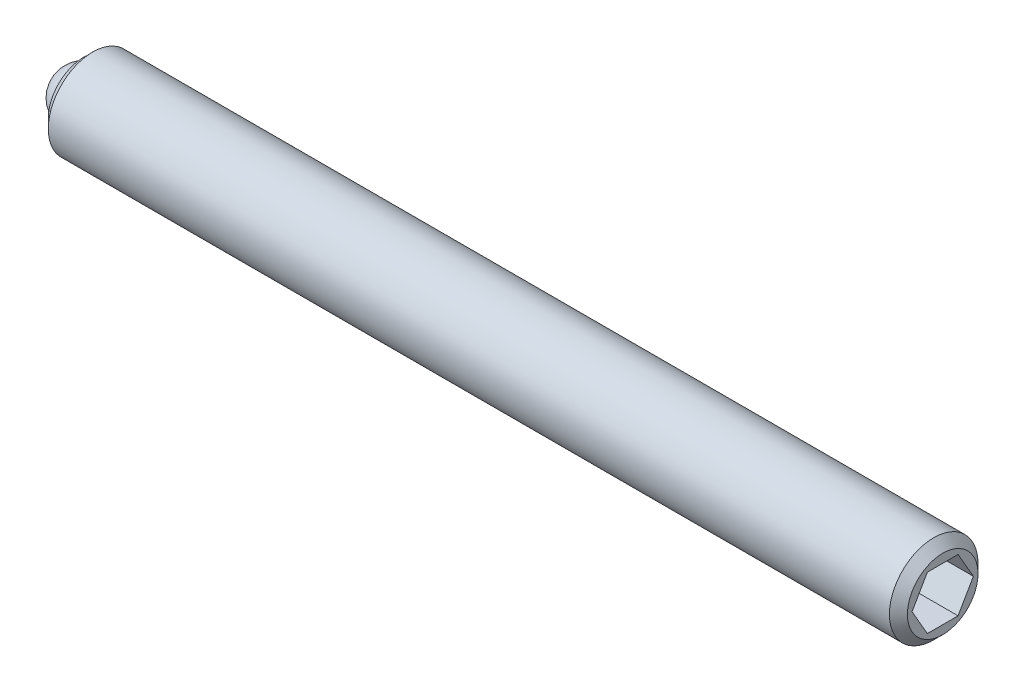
SolidWorks part; units mm, degrees
ref_plane "Front Plane" through (0, 0, 0) normal (0, 0, 1) x (1, 0, 0)
ref_plane "Top Plane" through (0, 0, 0) normal (0, 1, 0) x (1, 0, 0)
ref_plane "Right Plane" through (0, 0, 0) normal (1, 0, 0) x (0, 0, -1)
sketch "Sketch2" plane through (0, 0, 0) normal (1, 0, 0) x (0, 0, -1)
  circle A0 centre (0, 0) radius 1.25
  dimension "D1" = 2.5
extrude "Boss-Extrude1" add sketch "Sketch2" along normal blind 24.25
sketch "Sketch3" plane through (0, 0, 0) normal (-1, 0, 0) x (0, 0, 1)
  circle A0 centre (0, 0) radius 0.75
  dimension "D1" = 1.5
chamfer "Chamfer1" distance 0.254 angle 45 1 edges at (0, 0, -1.25)
chamfer "Chamfer2" distance 0.254 angle 45 1 edges at (24.25, 0, -1.25)
sketch "Sketch4" plane through (24.25, 0, 0) normal (1, 0, 0) x (0, 0, -1)
  line L1 (0.866, 0) -> (0.433, 0.75)
  line L2 (0.433, 0.75) -> (-0.433, 0.75)
  line L3 (-0.433, 0.75) -> (-0.866, 0)
  line L4 (-0.866, 0) -> (-0.433, -0.75)
  line L5 (-0.433, -0.75) -> (0.433, -0.75)
  line L6 (0.433, -0.75) -> (0.866, 0)
  circle A0 centre (0, 0) radius 0.75 construction
  dimension "D1" = 1.5
extrude "Cut-Extrude2" cut sketch "Sketch4" against normal blind 2
extrude "Cut-Extrude3" cut sketch "Sketch3" against normal blind 0.8
sketch "Sketch5" plane through (0, 0, 0) normal (-1, 0, 0) x (0, 0, 1)
  line L0 (0, 0) -> (0, -0.75)
  line L1 (0, 0) -> (0, 0.75)
  arc A0 (0, 0.75) -> (0, -0.75) centre (0, 0) ccw
  dimension "D1" = 0.75
revolve "Revolve1" add sketch "Sketch5" angle 360 about L1
